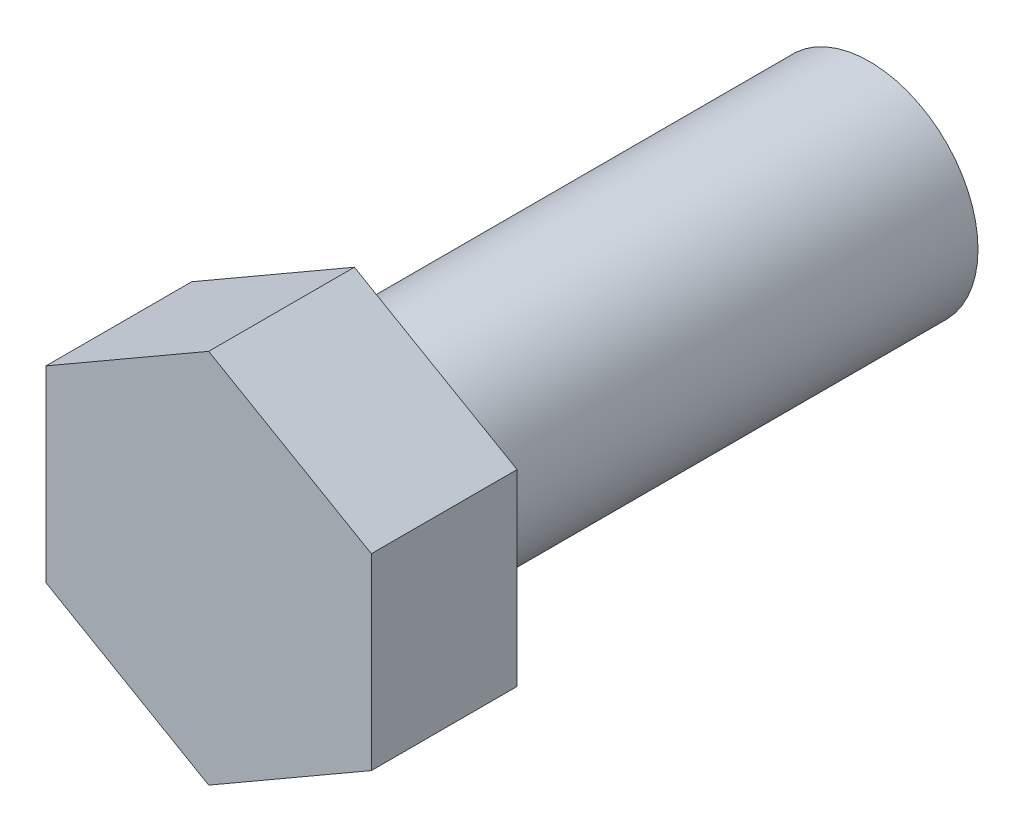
SolidWorks part; units mm, degrees
ref_plane "Front Plane" through (0, 0, 0) normal (1, 0, 0) x (0, 1, 0)
ref_plane "Top Plane" through (0, 0, 0) normal (0, 0, 1) x (0, 1, 0)
ref_plane "Right Plane" through (0, 0, 0) normal (0, 1, 0) x (-1, 0, 0)
sketch "Sketch1"
sketch_block_instance "W14x730-1-1"
sketch_block "W14x730-1" parameters "D4"=15.24, "D1"=454.406, "D2"=569.468, "D3"=77.978, "D5"=124.714
sketch "sk body" plane through (0, 0, 0) normal (0, 0, 1) x (0, 1, 0)
  circle A0 centre (0, 0) radius 50.8
  dimension "D1" = 101.6
sketch "sk Max dia" plane through (0, 0, 0) normal (0, 0, 1) x (0, 1, 0)
  circle A0 centre (0, 0) radius 52.2097
  dimension "D1" = 104.4194
sketch "Sketch3" plane through (0, 0, 0) normal (0, 0, 1) x (0, 1, 0)
  line L1 (87.9882, 0) -> (43.9941, 76.2)
  line L2 (43.9941, 76.2) -> (-43.9941, 76.2)
  line L3 (-43.9941, 76.2) -> (-87.9882, 0)
  line L4 (-87.9882, 0) -> (-43.9941, -76.2)
  line L5 (-43.9941, -76.2) -> (43.9941, -76.2)
  line L6 (43.9941, -76.2) -> (87.9882, 0)
  circle A0 centre (0, 0) radius 76.2 construction
  dimension "D1" = 152.4
extrude "bolt Head" add sketch "Sketch3" along normal blind 68.2625
extrude "bolt Body" add sketch "sk body" against normal blind 241.3
